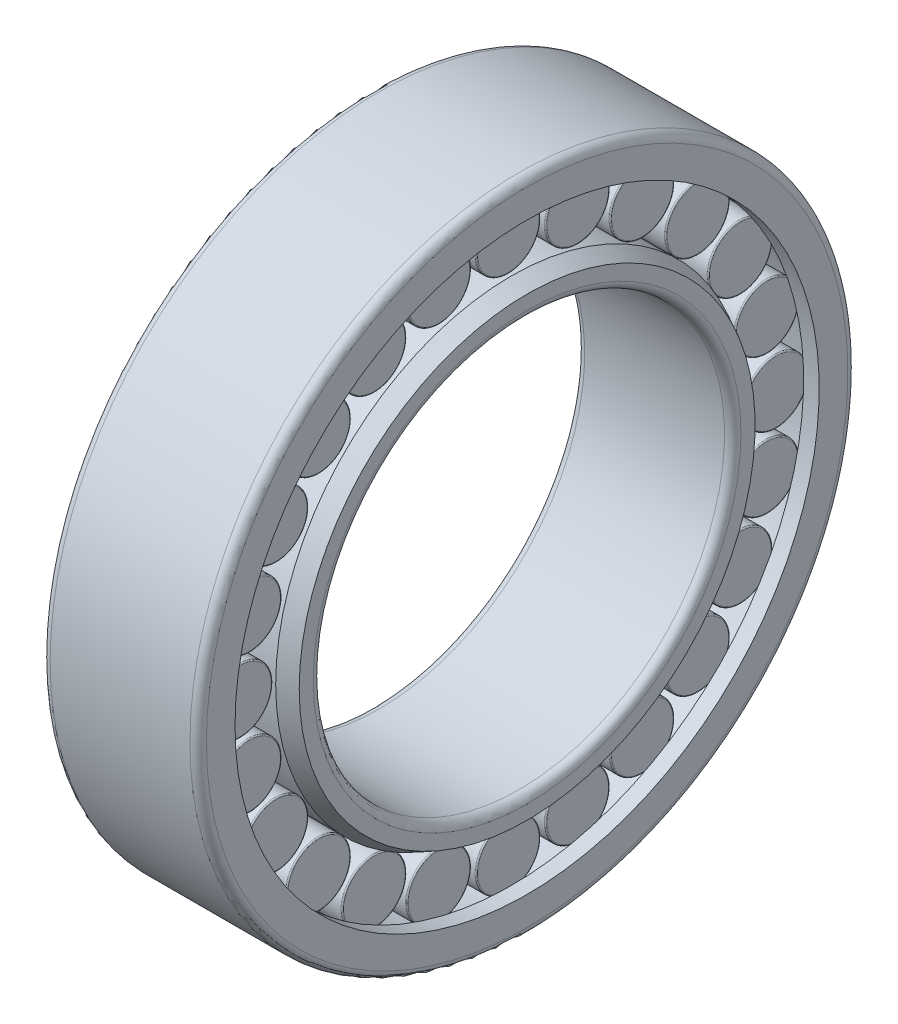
SolidWorks part; units mm, degrees
ref_plane "Front" through (0, 0, 0) normal (0, 0, 1) x (1, 0, 0)
ref_plane "Top" through (0, 0, 0) normal (0, 1, 0) x (1, 0, 0)
ref_plane "Right" through (0, 0, 0) normal (1, 0, 0) x (0, 0, -1)
sketch "Sketch1" plane through (0, 0, 0) normal (0, 0, 1) x (1, 0, 0)
  line L0 (0, 0) -> (0, 30.5672) construction
  line L1 (-7.6, 28.675) -> (7.6, 28.675)
  line L2 (-9.5, 27.715) -> (-9.5, 26)
  line L3 (-8.5, 25) -> (8.5, 25)
  line L4 (9.5, 27.715) -> (9.5, 26)
  line L5 (-17.9104, 0) -> (15.0448, 0) construction
  line L6 (-9.5, 27.715) -> (-7.6, 28.675)
  line L7 (9.5, 27.715) -> (7.6, 28.675)
  arc A0 (8.5, 25) -> (9.5, 26) centre (8.5, 26) ccw
  arc A1 (-9.5, 26) -> (-8.5, 25) centre (-8.5, 26) ccw
  point P11 (9.5, 25)
  point P14 (-9.5, 25)
  dimension "D4" = 1
  dimension "D1" = 19
  dimension "D2" = 50
  dimension "D3" = 57.35
  dimension "D5" = 15.2
  dimension "D6" = 0.96
revolve "Revolve2" add sketch "Sketch1" angle 360 about L5
sketch "Sketch2" plane through (0, 0, 0) normal (0, 0, 1) x (1, 0, 0)
  line L0 (-16.5788, 0) -> (23.2655, 0) construction
  line L1 (-7.07, 28.675) -> (7.07, 28.675)
  line L2 (-7.22, 28.825) -> (-7.22, 32.5775)
  line L3 (-7.22, 32.5775) -> (7.22, 32.5775)
  line L4 (7.22, 28.825) -> (7.22, 32.5775)
  line L5 (0, 0) -> (0, 82.4944) construction
  line L6 (-10.1308, 32.5775) -> (10.5893, 32.5775) construction
  arc A0 (-7.22, 28.825) -> (-7.07, 28.675) centre (-7.07, 28.825) ccw
  arc A1 (7.22, 28.825) -> (7.07, 28.675) centre (7.07, 28.825) cw
  point P9 (-7.22, 28.675)
  point P12 (7.22, 28.675)
  dimension "D3" = 0.15
  dimension "D1" = 65.155
  dimension "D2" = 14.44
  dimension "D4" = 57.35
revolve "Revolve3" add sketch "Sketch2" angle 360 about L6
sketch "Sketch3" plane through (0, 0, 0) normal (0, 0, 1) x (1, 0, 0)
  line L0 (-7.6, 35.52) -> (-7.6, 36.48)
  line L1 (-8.5, 40) -> (8.5, 40)
  line L2 (-9.5, 39) -> (-9.5, 35.52)
  line L3 (-9.5, 35.52) -> (-7.6, 35.52)
  line L4 (9.5, 39) -> (9.5, 35.52)
  line L5 (-7.6, 36.48) -> (7.6, 36.48)
  line L6 (7.6, 36.48) -> (7.6, 35.52)
  line L7 (7.6, 35.52) -> (9.5, 35.52)
  line L8 (0, 0) -> (0, 61.5688) construction
  line L9 (-25.7661, 0) -> (21.4116, 0) construction
  arc A0 (-8.5, 40) -> (-9.5, 39) centre (-8.5, 39) ccw
  arc A1 (8.5, 40) -> (9.5, 39) centre (8.5, 39) cw
  dimension "D1" = 1
  dimension "D2" = 0.96
  dimension "D3" = 19
  dimension "D4" = 15.2
  dimension "D5" = 80
  dimension "D6" = 72.96
revolve "Revolve4" add sketch "Sketch3" angle 360 about L9
pattern_circular "CirPattern1" count 24 over 360 about axis through (0, 0, 0) along (1, 0, 0)
